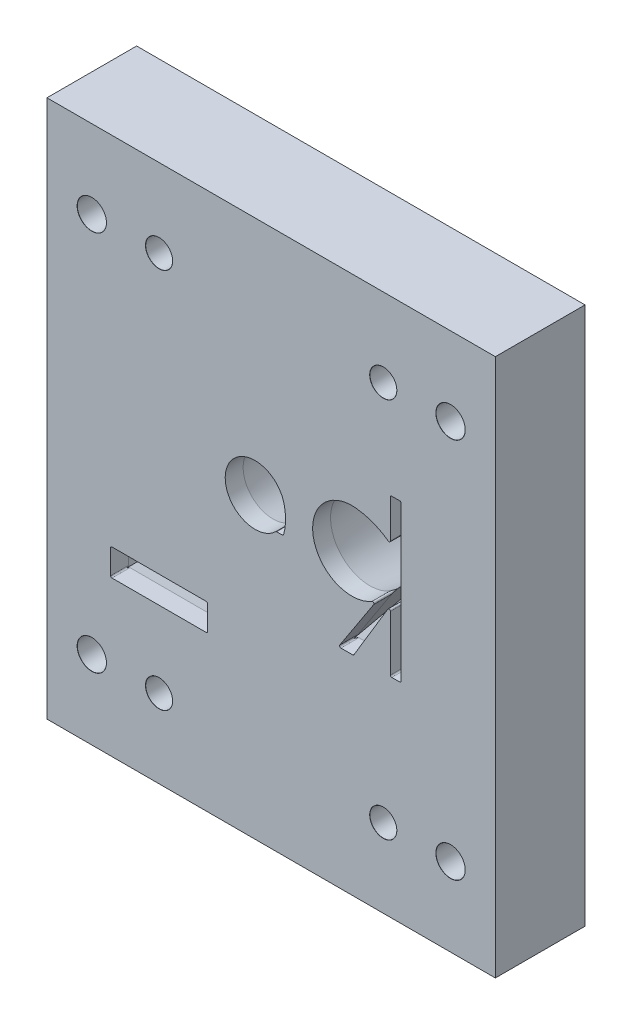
SolidWorks part; units mm, degrees
ref_plane "Alzado" through (0, 0, 0) normal (0, 0, 1) x (1, 0, 0)
ref_plane "Planta" through (0, 0, 0) normal (0, 1, 0) x (1, 0, 0)
ref_plane "Vista lateral" through (0, 0, 0) normal (1, 0, 0) x (0, 0, -1)
sketch "Sketch1" plane through (0, 0, 0) normal (0, 0, 1) x (1, 0, 0)
  line L1 (-50, 60) -> (50, 60)
  line L2 (-50, 60) -> (-50, -60)
  line L3 (-50, -60) -> (50, -60)
  line L4 (50, 60) -> (50, -60)
  line L5 (-50, 60) -> (50, -60) construction
  line L6 (-50, -60) -> (50, 60) construction
  point P0 (0, 0)
  dimension "D1" = 100
  dimension "D2" = 120
extrude "Boss-Extrude1" add sketch "Sketch1" along normal blind 20
sketch "Sketch2" plane through (0, 0, 20) normal (0, 0, 1) x (1, 0, 0)
  line L0 (0, 60) -> (0, -60) construction
  line L1 (50, 60) -> (-50, 60) construction
  line L2 (-50, -60) -> (50, -60) construction
  line L3 (-50, 0) -> (50, 0) construction
  line L4 (-50, 60) -> (-50, -60) construction
  line L5 (50, -60) -> (50, 60) construction
  point P12 (-25, -42.5)
  point P13 (-40, -42.5)
  point P14 (0, 0)
  point P15 (-40, 42.5)
  point P16 (-31.4981, -42.5)
  point P17 (-25, 42.5)
  point P18 (40, 42.5)
  point P19 (40, -42.5)
  point P20 (25, -42.5)
  point P21 (25, 42.5)
  dimension "D1" = 17.5
  dimension "D2" = 25
  dimension "D3" = 15
hole_wizard "Ø6.5 (6.5) Diameter Hole1" positions "Sketch3" profile "Sketch4" hole size "Ø6.5" standard "DIN"
sketch "Sketch3" plane through (0, 0, 20) normal (0, 0, 1) x (1, 0, 0)
  point P0 (-40, 42.5)
  point P3 (40, 42.5)
  point P6 (40, -42.5)
  point P9 (-40, -42.5)
sketch "Sketch4" plane through (-40, 42.5, 20) normal (1, 0, 0) x (0, -1, 0)
  line L0 (0, 0) -> (0, 20)
  line L1 (0, 20) -> (3.25, 20)
  line L2 (3.25, 20) -> (3.25, 0.025)
  line L3 (3.25, 0.025) -> (3.275, 0)
  line L5 (3.275, 0) -> (0, 0)
  line L6 (-3.25, 0.025) -> (-3.275, 0) construction
  line L11 (0, -6.35) -> (0, 107.95) construction
  dimension "Thru Hole Dia." = 6.5
  dimension "Thru Hole Depth" = 20
  dimension "Near C'Sink Dia." = 6.55
  dimension "Near C'Sink Angle" = 90
hole_wizard "Ø6.0 (6) Diameter Hole1" positions "Sketch5" profile "Sketch6" hole size "Ø6.0" standard "DIN"
sketch "Sketch5" plane through (0, 0, 20) normal (0, 0, 1) x (1, 0, 0)
  point P0 (-25, 42.5)
  point P3 (25, 42.5)
  point P6 (25, -42.5)
  point P9 (-25, -42.5)
sketch "Sketch6" plane through (-25, 42.5, 20) normal (1, 0, 0) x (0, -1, 0)
  line L0 (0, 0) -> (0, 20)
  line L1 (0, 20) -> (3, 20)
  line L2 (3, 20) -> (3, 0.025)
  line L3 (3, 0.025) -> (3.025, 0)
  line L5 (3.025, 0) -> (0, 0)
  line L6 (-3, 0.025) -> (-3.025, 0) construction
  line L11 (0, -6.35) -> (0, 107.95) construction
  dimension "Thru Hole Dia." = 6
  dimension "Thru Hole Depth" = 20
  dimension "Near C'Sink Dia." = 6.05
  dimension "Near C'Sink Angle" = 90
sketch "Sketch7" plane through (0, 0, 20) normal (0, 0, 1) x (1, 0, 0)
  line L0 (23.7448, -0.1) -> (15, -13.5)
  line L1 (-35.8, -19.5) -> (-14.2, -19.5)
  line L2 (-35.8, -19.5) -> (-35.8, -25.5)
  line L3 (-35.8, -25.5) -> (-14.2, -25.5)
  line L4 (-14.2, -19.5) -> (-14.2, -25.5)
  line L5 (26.6, 21.5) -> (29, 21.5)
  line L6 (26.6, 21.5) -> (26.6, 12.1)
  line L7 (26.6, -13.5) -> (29, -13.5)
  line L8 (29, 21.5) -> (29, -13.5)
  line L9 (26.6, 0.2) -> (18.36, -13.5)
  line L12 (26.6, 0.2) -> (26.6, -13.5)
  line L13 (15, -13.5) -> (18.36, -13.5)
  line L14 (1.1, 1.7955) -> (2.7, 1.7955)
  arc A2 (18.894, 15.2042) -> (23.7448, -0.1) centre (18, 6.5) ccw
  arc A3 (26.6, 12.1) -> (18.894, 15.2042) centre (17.3614, 0.2827) ccw
  arc A4 (2.8247, 8.2165) -> (1.1, 1.7955) centre (-3.6, 6.5) ccw
  circle A5 centre (-25, -42.5) radius 3.025 construction
  arc A6 (2.7, 1.7955) -> (2.8247, 8.2165) centre (-8.3823, 5.2223) ccw
  point P4 (-25, -25.5)
  point P24 (0, 0)
  dimension "D4" = 5.6
  dimension "D10" = 15
  dimension "D11" = 8.75
  dimension "D15" = 13.3
  dimension "D19" = 23.2
  dimension "D1" = 21.6
  dimension "D2" = 6
  dimension "D3" = 17
  dimension "D5" = 20
  dimension "D6" = 8.6
  dimension "D7" = 11
  dimension "D8" = 3
  dimension "D9" = 15
  dimension "D12" = 6.6
  dimension "D13" = 6.3
  dimension "D14" = 0.36
  dimension "D16" = 43
  dimension "D17" = 49
  dimension "D18" = 21.4
  dimension "D20" = 4.7
  dimension "D21" = 6.3
extrude "Cut-Extrude1" cut sketch "Sketch7" against normal blind 4
sketch "Sketch8" plane through (0, 0, 16) normal (0, 0, 1) x (1, 0, 0)
  line L0 (1.1, 1.7955) -> (2.7, 1.7955)
  line L1 (-35.8, -19.5) -> (-14.2, -19.5)
  line L2 (-35.8, -19.5) -> (-35.8, -25.5)
  line L3 (-35.8, -25.5) -> (-14.2, -25.5)
  line L4 (-14.2, -19.5) -> (-14.2, -25.5)
  line L5 (26.6, 12.1) -> (26.6, 21.5)
  line L6 (26.6, 21.5) -> (29, 21.5)
  line L7 (29, 21.5) -> (29, -13.5)
  line L8 (29, -13.5) -> (26.6, -13.5)
  line L9 (26.6, -13.5) -> (26.6, 0.2)
  line L10 (26.6, 0.2) -> (18.36, -13.5)
  line L11 (18.36, -13.5) -> (15, -13.5)
  line L12 (15, -13.5) -> (23.7448, -0.1)
  arc A0 (2.8247, 8.2165) -> (1.1, 1.7955) centre (-3.6, 6.5) ccw
  arc A1 (2.7, 1.7955) -> (2.8247, 8.2165) centre (-8.3823, 5.2223) ccw
  arc A2 (18.894, 15.2042) -> (23.7448, -0.1) centre (18, 6.5) ccw
  arc A5 (26.6, 12.1) -> (18.894, 15.2042) centre (17.3614, 0.2827) ccw
  point P25 (0, 0)
  point P39 (23.7448, -0.1)
extrude "Cut-Extrude2" cut sketch "Sketch8" against normal through all draft 10
fillet "Fillet1" radius 0.3 15 edges at (29, 21.5, 18) (26.6, 21.5, 18) (26.6, 12.1, 18) (29, -13.5, 18) (26.6, -13.5, 18) (15, -13.5, 18) (18.36, -13.5, 18) (26.6, 0.2, 18) (23.7448, -0.1, 18) (1.1, 1.7955, 18) (2.7, 1.7955, 18) (-14.2, -25.5, 18) (-14.2, -19.5, 18) (-35.8, -19.5, 18) (-35.8, -25.5, 18)
